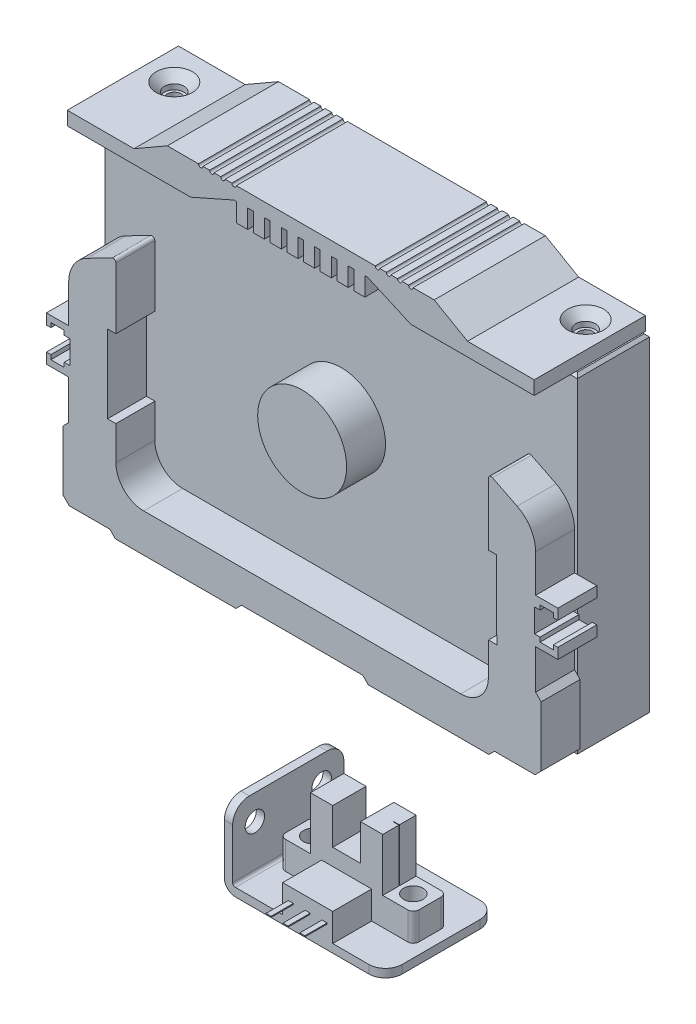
SolidWorks part; units mm, degrees
ref_plane "前视基准面" through (0, 0, 0) normal (0, 0, 1) x (1, 0, 0)
ref_plane "上视基准面" through (0, 0, 0) normal (0, 1, 0) x (1, 0, 0)
ref_plane "右视基准面" through (0, 0, 0) normal (1, 0, 0) x (0, 0, -1)
imported_body "输入1"
sketch "草图1" plane through (0, -18.6701, 0) normal (0, -1, 0) x (1, 0, 0)
  line L0 (49.9108, -131.5683) -> (58.4461, 259.2677)
  line L3 (58.4461, 259.2677) -> (-140.1135, 259.2677)
  line L4 (-140.1135, 259.2677) -> (-140.1135, -300)
  line L5 (-140.1135, -300) -> (18.0014, -300)
  line L6 (18.0014, -300) -> (18.0014, -166.0691)
  line L7 (18.0014, -166.0691) -> (49.9108, -131.5683)
  line L9 (18.0014, -257) -> (18.0014, -307) construction
  line L10 (-14.8486, -320) -> (-39.8486, -320) construction
  dimension "D1" = 20
extrude "切除-拉伸1" cut sketch "草图1" against normal up to surface (65.9 mm away)
